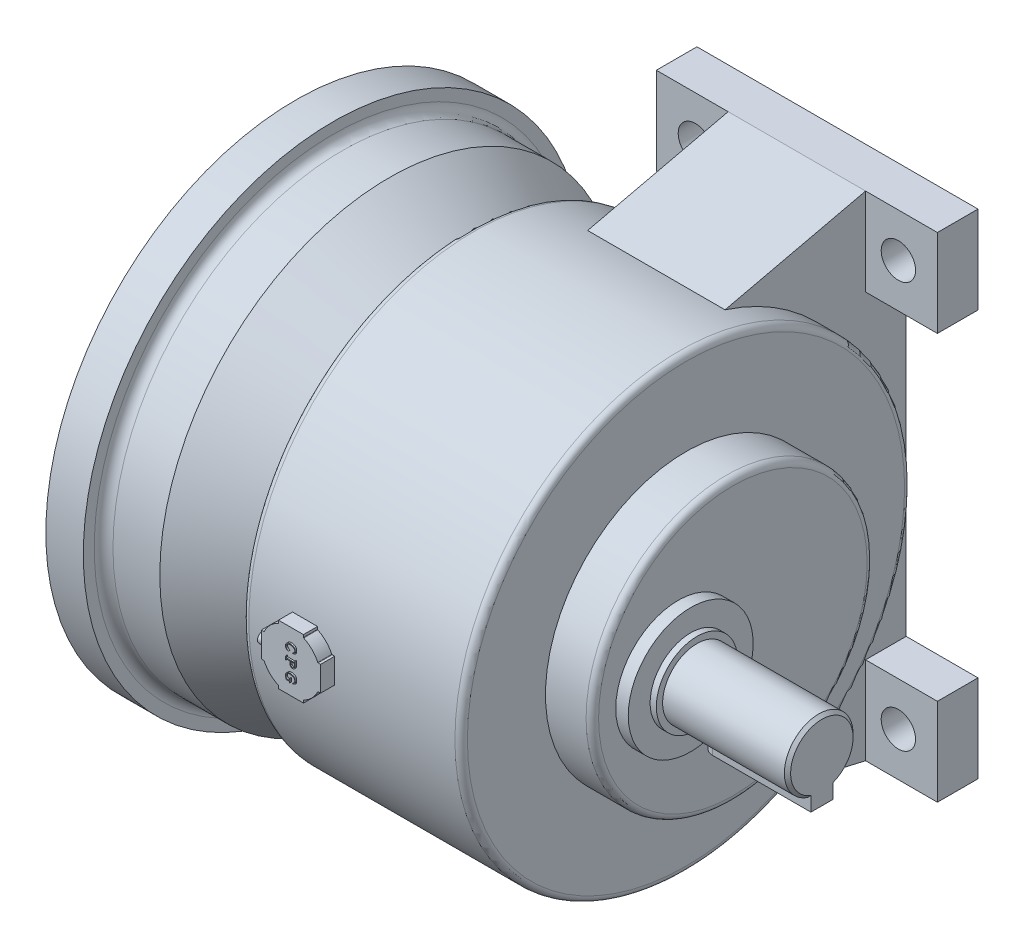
SolidWorks part; units mm, degrees
ref_plane "前视基准面" through (0, 0, 0) normal (0, 0, 1) x (1, 0, 0)
ref_plane "上视基准面" through (0, 0, 0) normal (0, 1, 0) x (1, 0, 0)
ref_plane "右视基准面" through (0, 0, 0) normal (1, 0, 0) x (0, 0, -1)
ref_plane "基准面1" through (0, 0, -97.5) normal (0, 0, 1) x (1, 0, 0)
sketch "草图1" plane through (0, 0, 0) normal (0, 1, 0) x (1, 0, 0)
  line L0 (0, 0) -> (33.1729, 0) construction
  line L1 (0, 0) -> (0, -11)
  line L2 (0, -11) -> (-40, -11)
  line L3 (-40, -11) -> (-40, -13)
  line L4 (-40, -13) -> (-42, -13)
  line L5 (-42, -13) -> (-42, -20)
  line L6 (-42, -20) -> (-46, -20)
  line L7 (-46, -20) -> (-46, 0)
  line L8 (-46, 0) -> (0, 0)
  dimension "D1" = 40
  dimension "D2" = 22
  dimension "D3" = 26
  dimension "D4" = 2
  dimension "D5" = 40
  dimension "D6" = 4
revolve "旋转1" add sketch "草图1" angle 360 about L0
sketch "草图2" plane through (0, 0, 0) normal (0, 1, 0) x (1, 0, 0)
  line L0 (8.0167, 17.5) -> (-46, 17.5) construction
  line L1 (-46, 17.5) -> (-46, -27.5)
  line L2 (-46, 20) -> (-46, -20) construction
  line L3 (-46, -27.5) -> (-61, -27.5)
  line L4 (-61, -27.5) -> (-61, -54.5)
  line L5 (-61, -54.5) -> (-131, -54.5)
  line L6 (-131, -54.5) -> (-131, 17.5)
  line L11 (-46, 17.5) -> (-131, 17.5)
  line L13 (-103.125, 97.5) -> (103.125, 97.5) construction
  dimension "D1" = 17.5
  dimension "D2" = 90
  dimension "D3" = 15
  dimension "D4" = 152
  dimension "D5" = 70
revolve "旋转2" add sketch "草图2" angle 360 about L0
sketch "草图3" plane through (0, 0, -97.5) normal (0, 0, 1) x (1, 0, 0)
  line L0 (0, 0) -> (40.0459, 0) construction
  line L1 (-137.5, -51) -> (-47.5, -51)
  line L2 (-137.5, -51) -> (-137.5, -79)
  line L3 (-137.5, -79) -> (-47.5, -79)
  line L4 (-47.5, -51) -> (-47.5, -79)
  line L5 (0, -11) -> (0, 11) construction
  circle A0 centre (-60, -65) radius 5.5
  circle A1 centre (-125, -65) radius 5.5
  dimension "D2" = 130
  dimension "D3" = 11
  dimension "D4" = 65
  dimension "D6" = 60
  dimension "D8" = 28
  dimension "D1" = 158
  dimension "D5" = 90
  dimension "D7" = 12.5
extrude "拉伸2" add sketch "草图3" along normal blind 13
mirror "镜向2" about plane through (0, 0, 0) normal (0, 1, 0)
ref_plane "基准面4" through (-92.5, 0, 0) normal (1, 0, 0) x (0, 0, -1)
sketch "草图4" plane through (-92.5, 0, 0) normal (1, 0, 0) x (0, 0, -1)
  line L0 (84.5, 51) -> (97.5, 51) construction
  line L1 (84.5, 51) -> (97.5, 51)
  line L2 (84.5, 79) -> (84.5, 51) construction
  line L3 (84.5, 79) -> (84.5, 51)
  line L4 (84.5, -51) -> (97.5, -51) construction
  line L5 (84.5, -51) -> (97.5, -51)
  line L6 (84.5, -79) -> (84.5, -51) construction
  line L7 (84.5, -79) -> (84.5, -51)
  line L8 (97.5, 51) -> (97.5, -51)
  line L9 (84.5, 79) -> (39.5, 68.5565)
  line L11 (39.5, -68.5565) -> (84.5, -79)
  arc A1 (39.5, -68.5565) -> (39.5, 68.5565) centre (17.5, 0) ccw
  circle A2 centre (17.5, 0) radius 72 construction
  dimension "D1" = 45
extrude "拉伸3" add sketch "草图4" against normal mid plane 44
sketch "草图5" plane through (0, 0, 0) normal (0, 1, 0) x (1, 0, 0)
  line L0 (0, -3.5) -> (-31.5, -3.5)
  line L1 (0, -11) -> (0, 11) construction
  line L2 (-31.5, 3.5) -> (0, 3.5)
  line L3 (0, 3.5) -> (0, -3.5)
  line L4 (25, -13.7955) -> (25, 19.6443) construction
  arc A0 (-31.5, -3.5) -> (-31.5, 3.5) centre (-31.5, 0) cw
  dimension "D2" = 35
  dimension "D1" = 7
  dimension "D3" = 25
extrude "拉伸4" add sketch "草图5" against normal blind 14
fillet "圆角1" radius 2 3 edges at (-131, 0, -89.5) (-61, 0, -89.5) (-46, 0, -62.5)
chamfer "倒角1" distance 1 angle 45 1 edges at (0, 11, 0)
sketch "草圖3" plane through (0, 0, 0) normal (0, 1, 0) x (1, 0, 0)
  line L1 (-181.9137, 67.488) -> (-182, 67.5871)
  line L9 (-186, 97.5) -> (-186, 73.5)
  line L10 (-185, 72.5) -> (-182, 72.5)
  line L11 (-182, 72.5) -> (-182, 67.5871)
  line L12 (-181.9137, 67.488) -> (-161, 64.5869)
  line L13 (-161, 57.0606) -> (-161, 51.5)
  line L14 (-164, 48.5) -> (-179, 48.5)
  line L15 (-180, 38.5) -> (-178.8, 38.5)
  line L16 (-180, 47.5) -> (-180, 38.5)
  line L17 (-178.5, 38.2) -> (-178.5, 17.5)
  line L26 (-15.3592, 17.5) -> (-187.5963, 17.5) construction
  line L27 (-131, 17.5) -> (-178.5, 17.5)
  line L28 (-131, 78.5) -> (-131, 17.5)
  line L29 (-131, 78.5) -> (-136, 78.5)
  line L30 (-136, 78.5) -> (-156, 91)
  line L31 (-156, 91) -> (-171, 91)
  line L32 (-174, 94) -> (-174, 97.5)
  line L33 (-174, 97.5) -> (-186, 97.5)
  line L34 (19.9234, 0) -> (-221.4481, 0) construction
  arc A6 (-186, 73.5) -> (-185, 72.5) centre (-185, 73.5) ccw
  arc A7 (-159.7461, 59.5001) -> (-161, 64.5869) centre (-161.3875, 61.7934) ccw
  arc A8 (-159.7461, 59.5001) -> (-161, 57.0606) centre (-158, 57.0606) ccw
  arc A9 (-164, 48.5) -> (-161, 51.5) centre (-164, 51.5) ccw
  arc A10 (-179, 48.5) -> (-180, 47.5) centre (-179, 47.5) ccw
  arc A11 (-178.5, 38.2) -> (-178.8, 38.5) centre (-178.8, 38.2) ccw
  arc A13 (-174, 94) -> (-171, 91) centre (-171, 94) ccw
  dimension "D1" = 17.5
  dimension "D2" = 160
  dimension "D3" = 110
  dimension "D4" = 55
revolve "旋轉1" add sketch "草圖3" angle 360 about L26
sketch "草圖5" plane through (-186, 0, 0) normal (-1, 0, 0) x (0, 0, 1)
  line L0 (67.7669, 0) -> (-124.3021, 0) construction
  line L2 (-17.5, 97.857) -> (-17.5, -89.8335) construction
  circle A0 centre (-17.5, 0) radius 65 construction
  circle A1 centre (28.4619, 45.9619) radius 4
  circle A2 centre (28.4619, -45.9619) radius 4
  circle A3 centre (-63.4619, -45.9619) radius 4
  circle A4 centre (-63.4619, 45.9619) radius 4
  dimension "D1" = 130
  dimension "D2" = 8
extrude "伸長1" cut sketch "草圖5" against normal blind 25
sketch "草圖7" plane through (-186, 0, 0) normal (-1, 0, 0) x (0, 0, 1)
  line L0 (-17.4992, 0) -> (-83.7629, 0) construction
  line L1 (-78.6326, 25.778) -> (-58.9287, 5.5251)
  line L2 (-78.6326, -25.2495) -> (-58.8647, -5.4747)
  line L3 (-57.9233, 10.7256) -> (-64.9943, 17.7967)
  line L4 (-35.2959, 47.4952) -> (-28.2248, 40.4241)
  line L5 (-64.2557, 35.0893) -> (-52.5885, 46.7566)
  line L6 (-43.2772, 61.1334) -> (-23.5024, 41.3656)
  line L7 (7.7503, 61.1334) -> (-12.5026, 41.4295)
  line L8 (17.0615, 46.7566) -> (28.7288, 35.0893)
  line L9 (-7.3021, 40.4241) -> (-0.2311, 47.4952)
  line L10 (29.4674, 17.7967) -> (22.3964, 10.7256)
  line L11 (43.1056, 25.778) -> (23.3378, 6.0033)
  line L12 (43.1056, -25.2495) -> (23.4017, -4.9966)
  line L13 (28.7288, -34.5607) -> (17.0615, -46.228)
  line L14 (22.3964, -10.197) -> (29.4674, -17.2681)
  line L15 (-0.2311, -46.9666) -> (-7.3021, -39.8955)
  line L16 (7.7503, -60.6048) -> (-12.0245, -40.837)
  line L17 (-43.2772, -60.6048) -> (-23.0243, -40.9009)
  line L18 (-52.5885, -46.228) -> (-64.2557, -34.5607)
  line L19 (-28.2248, -39.8955) -> (-35.2959, -46.9666)
  line L20 (-64.9943, -17.2681) -> (-57.9233, -10.197)
  line L21 (17.0615, 46.7566) -> (28.7288, 35.0893)
  line L22 (-7.3021, 40.4241) -> (-0.2311, 47.4952)
  line L23 (29.4674, 17.7967) -> (22.3964, 10.7256)
  line L24 (22.3964, -10.197) -> (29.4674, -17.2681)
  line L25 (-0.2311, -46.9666) -> (-7.3021, -39.8955)
  line L26 (28.7288, -34.5607) -> (17.0615, -46.228)
  line L27 (-52.5885, -46.228) -> (-64.2557, -34.5607)
  line L28 (-64.9943, -17.2681) -> (-57.9233, -10.197)
  line L29 (-28.2248, -39.8955) -> (-35.2959, -46.9666)
  arc A0 (-78.6326, 25.778) -> (-78.6326, -25.2495) centre (-17.7635, 0.2643) ccw
  arc A1 (-28.2248, 40.4241) -> (-57.9233, 10.7256) centre (-17.7635, 0.2643) ccw
  arc A2 (22.3964, 10.7256) -> (-7.3021, 40.4241) centre (-17.7635, 0.2643) ccw
  arc A3 (-58.9287, 5.5251) -> (-58.8647, -5.4747) centre (-17.7635, 0.2643) ccw
  arc A4 (7.7503, 61.1334) -> (-43.2772, 61.1334) centre (-17.7635, 0.2643) ccw
  arc A5 (-12.5026, 41.4295) -> (-23.5024, 41.3656) centre (-17.7635, 0.2643) ccw
  arc A6 (-7.3021, -39.8955) -> (22.3964, -10.197) centre (-17.7635, 0.2643) ccw
  arc A7 (43.1056, -25.2495) -> (43.1056, 25.778) centre (-17.7635, 0.2643) ccw
  arc A8 (23.4017, -4.9966) -> (23.3378, 6.0033) centre (-17.7635, 0.2643) ccw
  arc A9 (-57.9233, -10.197) -> (-28.2248, -39.8955) centre (-17.7635, 0.2643) ccw
  arc A10 (-43.2772, -60.6048) -> (7.7503, -60.6048) centre (-17.7635, 0.2643) ccw
  arc A11 (-23.0243, -40.9009) -> (-12.0245, -40.837) centre (-17.7635, 0.2643) ccw
  arc A12 (22.3964, 10.7256) -> (-7.3021, 40.4241) centre (-17.7635, 0.2643) ccw
  arc A13 (-7.3021, -39.8955) -> (22.3964, -10.197) centre (-17.7635, 0.2643) ccw
  arc A14 (-57.9233, -10.197) -> (-28.2248, -39.8955) centre (-17.7635, 0.2643) ccw
  spline S0 degree 2 poles (-64.9943, 17.7967) (-69.8347, 26.6584) (-64.2557, 35.0893) knots 0 0 0 1 1 1
  spline S1 degree 2 poles (-35.2959, 47.4952) (-44.1575, 52.3355) (-52.5885, 46.7566) knots 0 0 0 1 1 1
  spline S2 degree 2 poles (29.4674, 17.7967) (34.3078, 26.6584) (28.7288, 35.0893) knots 0 0 0 1 1 1
  spline S3 degree 2 poles (-0.2311, 47.4952) (8.6306, 52.3355) (17.0615, 46.7566) knots 0 0 0 1 1 1
  spline S4 degree 2 poles (-0.2311, -46.9666) (8.6306, -51.807) (17.0615, -46.228) knots 0 0 0 1 1 1
  spline S5 degree 2 poles (29.4674, -17.2681) (34.3078, -26.1298) (28.7288, -34.5607) knots 0 0 0 1 1 1
  spline S6 degree 2 poles (-64.9943, -17.2681) (-69.8347, -26.1298) (-64.2557, -34.5607) knots 0 0 0 1 1 1
  spline S7 degree 2 poles (-35.2959, -46.9666) (-44.1575, -51.807) (-52.5885, -46.228) knots 0 0 0 1 1 1
extrude "伸長2" cut sketch "草圖7" against normal blind 39 draft 1 contours L0 L1 A0 M5 | L0 A0 L2 M5 | L0 A3 L1 M5 | A3 L0 L2 M5 | L4 S1 S0 L3 A1 M5 | S1 L5 S0 M5 | L7 A4 L6 M5 | A5 L7 L6 M5 | S3 S2 L8 M5 | L12 A7 L11 M5 | A8 L12 L11 M5 | S5 L14 A6 L15 S4 M5 | S5 S4 L13 M5 | L17 A10 L16 M5 | A11 L17 L16 M5 | S7 L19 A9 L20 S6 M5 | S3 L9 A2 L10 S2 M5
sketch "草圖8" plane through (-147, 0, 0) normal (-1, 0, 0) x (0, 0, 1)
  line L0 (-78.5, 0) -> (-17.5, 0) construction
  circle A0 centre (-17.5, 0) radius 51.5 construction
  circle A1 centre (-53.916, 36.416) radius 3
  circle A2 centre (18.916, 36.416) radius 3
  circle A3 centre (18.916, -36.416) radius 3
  circle A4 centre (-53.916, -36.416) radius 3
  dimension "D1" = 103
  dimension "D2" = 6
extrude "伸長3" cut sketch "草圖8" against normal blind 11
sketch "草圖9" plane through (-178.5, 0, 0) normal (-1, 0, 0) x (0, 0, 1)
  line L0 (-17.5034, -16.5253) -> (-17.5034, 16) construction
  line L3 (-35.2448, 0) -> (-0.9193, 0) construction
  line L5 (-10.2034, 2) -> (-10.2034, -2)
  line L6 (-10.2034, -2) -> (-12.3799, -2)
  line L7 (-10.2034, 2) -> (-12.3799, 2)
  circle A0 centre (-17.5034, 0) radius 12.5 construction
  arc A1 (-12.3799, 2) -> (-12.3799, -2) centre (-17.5034, 0) ccw
  dimension "D1" = 25
  dimension "D2" = 11
  dimension "D3" = 7.3
  dimension "D4" = 4
extrude "伸長4" cut sketch "草圖9" against normal blind 28
sketch "草圖10" plane through (-178.5, 0, 0) normal (-1, 0, 0) x (0, 0, 1)
  line L0 (-12.3799, -2) -> (-10.2034, -2) construction
  line L1 (-10.2034, -2) -> (-10.2034, 2) construction
  line L2 (-12.3799, -2) -> (-10.2034, -2)
  line L3 (-10.2034, -2) -> (-10.2034, 2)
  circle A0 centre (-17.5034, 0) radius 14
  arc A1 (-12.3799, 2) -> (-12.3799, -2) centre (-17.5034, 0) ccw construction
  arc A2 (-12.3799, 2) -> (-12.3799, -2) centre (-17.5034, 0) ccw
  dimension "D1" = 28
extrude "伸長5" add sketch "草圖10" along normal blind 1 contours A0 M4 M1 M2 M3
ref_plane "平面1" through (0, 0, 59) normal (0, 0, 1) x (1, 0, 0)
sketch "草圖11" plane through (0, 0, 59) normal (0, 0, 1) x (1, 0, 0)
  line L0 (-115, 9.5) -> (-107, 9.5)
  line L2 (-115, 8.7121) -> (-115, 9.5)
  line L3 (-107, 8.7121) -> (-107, 9.5)
  line L4 (-119.7121, 4) -> (-120.5, 4)
  line L5 (-119.7121, -4) -> (-120.5, -4)
  line L6 (-120.5, -4) -> (-120.5, 4)
  line L7 (-115, -8.7121) -> (-115, -9.5)
  line L8 (-107, -8.7121) -> (-107, -9.5)
  line L9 (-107, -9.5) -> (-115, -9.5)
  line L10 (-102.2879, -4) -> (-101.5, -4)
  line L11 (-102.2879, 4) -> (-101.5, 4)
  line L12 (-101.5, 4) -> (-101.5, -4)
  arc A0 (-115.0855, 8.5766) -> (-119.5766, 4.0855) centre (-111, 0) ccw
  arc A1 (-115.0855, 8.5766) -> (-115, 8.7121) centre (-115.15, 8.7121) ccw
  arc A2 (-107, 8.7121) -> (-106.9145, 8.5766) centre (-106.85, 8.7121) ccw
  arc A3 (-119.7121, 4) -> (-119.5766, 4.0855) centre (-119.7121, 4.15) ccw
  arc A4 (-119.5766, -4.0855) -> (-119.7121, -4) centre (-119.7121, -4.15) ccw
  arc A5 (-115, -8.7121) -> (-115.0855, -8.5766) centre (-115.15, -8.7121) ccw
  arc A6 (-106.9145, -8.5766) -> (-107, -8.7121) centre (-106.85, -8.7121) ccw
  arc A7 (-102.2879, -4) -> (-102.4234, -4.0855) centre (-102.2879, -4.15) ccw
  arc A8 (-102.4234, 4.0855) -> (-102.2879, 4) centre (-102.2879, 4.15) ccw
  arc A9 (-119.5766, -4.0855) -> (-115.0855, -8.5766) centre (-111, 0) ccw
  arc A10 (-106.9145, -8.5766) -> (-102.4234, -4.0855) centre (-111, 0) ccw
  arc A11 (-102.4234, 4.0855) -> (-106.9145, 8.5766) centre (-111, 0) ccw
extrude "伸長6" add sketch "草圖11" against normal blind 4.5 separate body
sketch "草圖12"
extrude "伸長7" add sketch "草圖12" along normal blind 0.5
sketch "草圖13" plane through (0, 0, 0) normal (0, 1, 0) x (1, 0, 0)
  line L0 (-119.4836, -55.7307) -> (-115.814, -55.9345)
  line L1 (-121.1145, -55.7307) -> (-119.4836, -55.7307)
  line L2 (-121.1145, -55.7307) -> (-121.1145, -55.1191)
  line L3 (-122.3376, -55.1191) -> (-121.1145, -55.1191)
  line L4 (-115.814, -56.75) -> (-115.814, -55.9345)
  line L5 (-115.814, -56.75) -> (-122.3376, -56.75)
  line L6 (-122.3376, -55.1191) -> (-122.3376, -56.75)
revolve "旋轉2" add sketch "草圖13" angle 360 about L5
equation "\"D7@草图3\"=(\"D5@草图3\"-\"D4@草图3\")/2"
equation "\"D8@草图3\" = \"D1@草图3\"-\"D2@草图3\""
equation "\"D1@拉伸4\" = \"D3@草图5\"-\"D2@草图1\"/2"
equation "\"D3@草图1\"=\"D2@草图1\"+4"
equation "\"D5@草图2\"=\"D5@草图3\"-20"
equation "\"D1@基准面4\"=\"D5@草图3\"/2"
equation "\"D1@拉伸3\" = \"D4@草图3\"-\"D3@草图3\"-10"
equation "\"D4@草圖3\"=\"D4@草图3\"-10"
